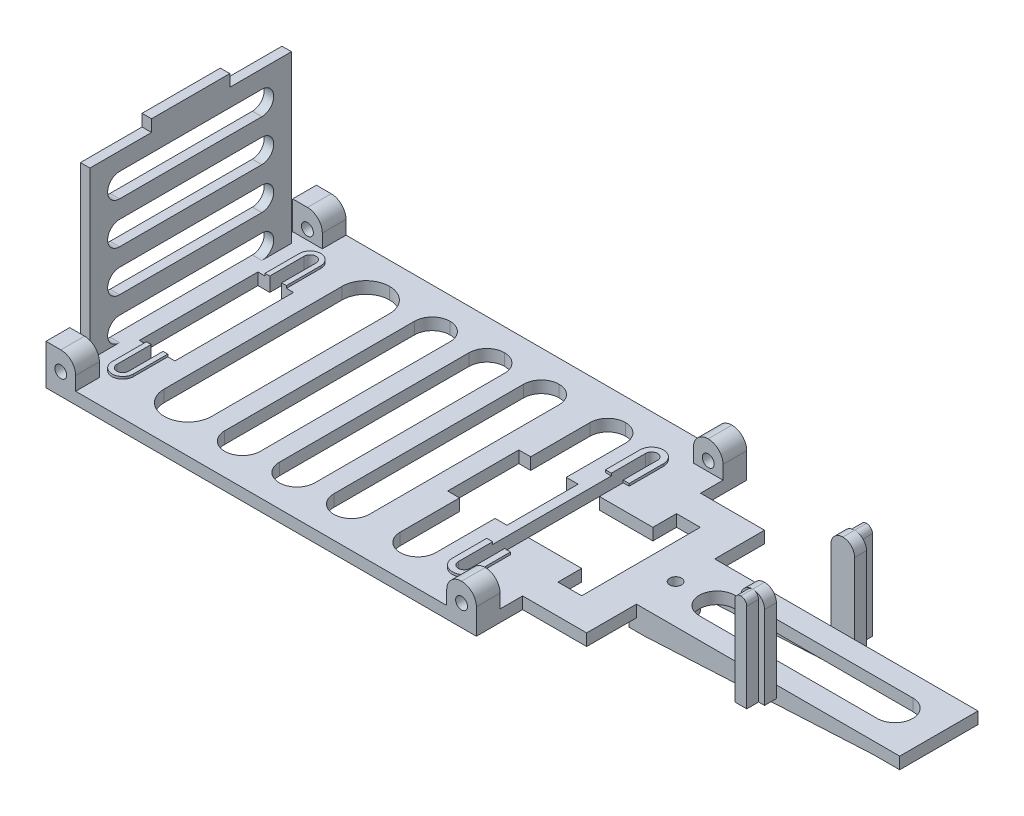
SolidWorks part; units mm, degrees
ref_plane "Face" through (0, 0, 0) normal (0, 0, 1) x (1, 0, 0)
ref_plane "Dessus" through (0, 0, 0) normal (0, 1, 0) x (1, 0, 0)
ref_plane "Droite" through (0, 0, 0) normal (1, 0, 0) x (0, 0, -1)
sketch "Esquisse1" plane through (0, 0, 0) normal (0, 1, 0) x (1, 0, 0)
  line L0 (0, 0) -> (63.89, 0)
  line L1 (0, 0) -> (0, 11.4)
  line L2 (0, 11.4) -> (36.29, 11.4)
  line L3 (36.29, 11.4) -> (36.29, 7.5)
  line L4 (36.29, 7.5) -> (41.69, 7.5)
  line L5 (41.69, 7.5) -> (41.69, 3.3)
  line L6 (41.69, 3.3) -> (63.89, 3.3)
  line L7 (63.89, 3.3) -> (63.89, 0)
  dimension "D1" = 11.4
  dimension "D2" = 36.29
  dimension "D3" = 5.4
  dimension "D4" = 22.2
  dimension "D5" = 7.5
  dimension "D6" = 3.3
extrude "Extrusion1" add sketch "Esquisse1" along normal blind 1
sketch "Esquisse2" plane through (0, 1, 0) normal (0, 1, 0) x (-1, 0, 0)
  line L0 (-1.47, 0) -> (-1.47, -5)
  line L1 (0, 0) -> (-63.89, 0) construction
  line L2 (-1.47, -5) -> (-2.47, -5)
  line L3 (-2.47, -5) -> (-2.47, -8.4)
  line L4 (-2.47, -8.4) -> (-3.47, -8.4)
  line L5 (-3.47, -8.4) -> (-3.47, -5)
  line L6 (-3.47, -5) -> (-4.47, -5)
  line L7 (-4.47, -5) -> (-4.47, 0)
  line L8 (-4.47, 0) -> (-1.47, 0)
  line L9 (-2.97, -8.4) -> (-2.97, 0) construction
  line L10 (0, -11.4) -> (0, 0) construction
  line L11 (-16.27, 0) -> (-19.27, 0)
  line L12 (-6.07, 0) -> (-10.07, 0)
  line L13 (-6.07, 0) -> (-6.07, -9.5)
  line L14 (-6.07, -9.5) -> (-10.07, -9.5)
  line L15 (-10.07, 0) -> (-10.07, -9.5)
  line L16 (-11.67, 0) -> (-14.67, 0)
  line L17 (-11.67, 0) -> (-11.67, -9.5)
  line L18 (-11.67, -9.5) -> (-14.67, -9.5)
  line L19 (-14.67, 0) -> (-14.67, -9.5)
  line L20 (-16.27, 0) -> (-16.27, -9.5)
  line L21 (-16.27, -9.5) -> (-19.27, -9.5)
  line L22 (-19.27, 0) -> (-19.27, -9.5)
  line L23 (-20.87, 0) -> (-23.87, 0)
  line L24 (-20.87, 0) -> (-20.87, -9.5)
  line L25 (-20.87, -9.5) -> (-23.87, -9.5)
  line L26 (-23.87, 0) -> (-23.87, -9.5)
  line L27 (-25.47, 0) -> (-25.47, -3)
  line L28 (-25.47, -3) -> (-26.47, -3)
  line L29 (-26.47, -3) -> (-26.47, -9.5)
  line L30 (-26.47, -9.5) -> (-29.47, -9.5)
  line L31 (-29.47, -9.5) -> (-29.47, -3)
  line L32 (-29.47, -3) -> (-30.47, -3)
  line L33 (-30.47, -3) -> (-30.47, 0)
  line L34 (-30.47, 0) -> (-25.47, 0)
  line L35 (-27.97, -9.5) -> (-27.97, 0) construction
  line L36 (-31.27, 0) -> (-31.27, -8.4)
  line L37 (-31.27, -8.4) -> (-32.27, -8.4)
  line L38 (-32.27, -8.4) -> (-32.27, -3)
  line L39 (-32.27, -3) -> (-36.77, -3)
  line L40 (-36.77, -3) -> (-36.77, -5)
  line L41 (-36.77, -5) -> (-38.77, -5)
  line L42 (-38.77, -5) -> (-38.77, 0)
  line L43 (-38.77, 0) -> (-31.27, 0)
  line L45 (-41.69, -3.3) -> (-41.69, -7.5) construction
  line L46 (-63.89, 0) -> (-63.89, -3.3) construction
  line L47 (-43.69, 0) -> (-61.69, 0)
  line L48 (-43.69, 0) -> (-43.69, -1.5)
  line L49 (-43.69, -1.5) -> (-61.69, -1.5)
  line L50 (-61.69, 0) -> (-61.69, -1.5)
  line L51 (-36.29, -11.4) -> (0, -11.4) construction
  circle A0 centre (-41.69, 0) radius 0.5
  dimension "D20" = 1
  dimension "D1" = 5
  dimension "D3" = 1
  dimension "D4" = 3
  dimension "D5" = 1.47
  dimension "D6" = 1.6
  dimension "D7" = 4
  dimension "D8" = 1.6
  dimension "D9" = 3
  dimension "D10" = 1.6
  dimension "D11" = 3
  dimension "D12" = 5
  dimension "D13" = 3
  dimension "D14" = 1.6
  dimension "D15" = 0.8
  dimension "D16" = 1
  dimension "D17" = 4.5
  dimension "D18" = 2
  dimension "D19" = 5
  dimension "D21" = 1.5
  dimension "D22" = 18
  dimension "D23" = 2.2
  dimension "D24" = 9.5
  dimension "D25" = 3
extrude "Extrusion2" cut sketch "Esquisse2" against normal through all
sketch "Esquisse4" plane through (0, 0, 0) normal (-1, 0, 0) x (0, 0, 1)
  line L0 (0, 2) -> (-6, 2) construction
  line L1 (-6, 1) -> (-8.5, 1)
  line L2 (0, 3) -> (0, 4.5)
  line L3 (0, 4.5) -> (-8.5, 4.5)
  line L4 (-8.5, 1) -> (-8.5, 4.5)
  line L5 (-6, 3) -> (0, 3)
  line L6 (0, 1) -> (0, 0) construction
  line L7 (0, 1) -> (0, 3) construction
  arc A0 (-6, 1) -> (-6, 3) centre (-6, 2) cw
  dimension "D4" = 3.5
  dimension "D1" = 8.5
  dimension "D2" = 6
  dimension "D3" = 2
extrude "Extrusion3" add sketch "Esquisse4" against normal blind 0.8
pattern_linear "Répétition linéaire1" count 4 spacing 3.5 along (0, 1, 0) of "Extrusion3"
sketch "Esquisse5" plane through (0, 0, 0) normal (-1, 0, 0) x (0, 0, 1)
  line L1 (0, 15) -> (-3.3, 15)
  line L2 (0, 15) -> (0, 16)
  line L3 (0, 16) -> (-3.3, 16)
  line L4 (-3.3, 15) -> (-3.3, 16)
  dimension "D1" = 1
  dimension "D2" = 3.3
extrude "Extrusion4" add sketch "Esquisse5" against normal up to surface (0.8 mm away)
sketch "Esquisse10" plane through (0, 0, 0) normal (0, 1, 0) x (-1, 0, 0)
  line L0 (-53.49, -3.3) -> (-51.49, -3.3)
  line L1 (-63.89, -3.3) -> (-41.69, -3.3) construction
  line L2 (-51.49, -3.3) -> (-51.49, -4.3)
  line L3 (-51.49, -4.3) -> (-51.99, -4.3)
  line L4 (-53.49, -4.3) -> (-53.49, -3.3)
  line L5 (-51.99, -4.3) -> (-51.99, -5.3)
  line L6 (-51.99, -5.3) -> (-52.99, -5.3)
  line L7 (-52.99, -5.3) -> (-52.99, -4.3)
  line L8 (-52.99, -4.3) -> (-53.49, -4.3)
  line L9 (-63.89, 0) -> (-63.89, -3.3) construction
  dimension "D1" = 1
  dimension "D2" = 2
  dimension "D3" = 12.4
  dimension "D4" = 0.5
  dimension "D5" = 1
  dimension "D6" = 1
extrude "Extrusion9" add sketch "Esquisse10" along normal blind 8
fillet "Congé2" radius 1.5 10 edges at (14.67, 0.5, -9.5) (19.27, 0.5, -9.5) (23.87, 0.5, -9.5) (11.67, 0.5, -9.5) (16.27, 0.5, -9.5) (20.87, 0.5, -9.5) (26.47, 0.5, -9.5) (29.47, 0.5, -9.5) (43.69, 0.5, -1.5) (61.69, 0.5, -1.5)
fillet "Congé3" radius 2 2 edges at (10.07, 0.5, -9.5) (6.07, 0.5, -9.5)
fillet "Congé4" radius 0.5 6 edges at (3.47, 0.5, -8.4) (2.47, 0.5, -8.4) (31.27, 0.5, -8.4) (32.27, 0.5, -8.4) (52.99, 8, -4.8) (51.99, 8, -4.8)
fillet "Congé6" radius 1 2 edges at (53.49, 8, -3.8) (51.49, 8, -3.8)
sketch "Esquisse7" plane through (0, 0, -11.4) normal (0, 0, -1) x (-1, 0, 0)
  line L0 (-36.29, 0) -> (0, 0) construction
  line L1 (-36.29, 1) -> (-33.79, 1)
  line L2 (-36.29, 1) -> (-36.29, 3.4)
  line L3 (-36.29, 3.4) -> (-33.79, 3.4)
  line L4 (-33.79, 1) -> (-33.79, 3.4)
  line L5 (0, 1) -> (0, 0) construction
  line L6 (-36.29, 1) -> (0, 1) construction
  circle A0 centre (-35.045, 1.8) radius 0.5
  point P11 (-18.145, 1)
  dimension "D3" = 1
  dimension "D1" = 3.4
  dimension "D2" = 2.5
  dimension "D4" = 1.8
  dimension "D5" = 36.29
  dimension "D6" = 1.245
  dimension "D7" = 16.9
extrude "Extrusion6" add sketch "Esquisse7" against normal blind 2
sketch "Esquisse11" plane through (0, 1, 0) normal (0, 1, 0) x (1, 0, 0)
  line L0 (2.47, 5) -> (2.47, 7.9)
  line L1 (3.47, 7.9) -> (3.47, 5)
  arc A0 (2.47, 7.9) -> (3.47, 7.9) centre (2.97, 7.9) cw
extrude "Extru.-Mince1" add sketch "Esquisse11" along normal blind 0.2 thin
sketch "Esquisse12" plane through (0, 1, 0) normal (0, 1, 0) x (1, 0, 0)
  line L0 (3.87, 5) -> (32.27, 5) construction
  line L1 (32.27, 3) -> (32.27, 7.9) construction
  line L2 (32.27, 5) -> (32.27, 7.9)
  line L3 (31.27, 7.9) -> (31.27, 5)
  line L4 (31.27, 7.9) -> (31.27, 0) construction
  arc A0 (32.27, 7.9) -> (31.27, 7.9) centre (31.77, 7.9) ccw
extrude "Extru.-Mince2" add sketch "Esquisse12" along normal up to surface (0.2 mm away) thin
ref_plane "Plan1" through (18.145, 0, 0) normal (1, 0, 0) x (0, 0, -1)
mirror "Symétrie2" about plane through (18.145, 0, 0) normal (1, 0, 0) of "Extrusion6"
fillet "Congé5" radius 1.25 3 edges at (2.5, 3.4, -10.4) (33.79, 3.4, -10.4) (36.29, 3.4, -10.4)
sketch "Esquisse8" plane through (0, 0, 0) normal (0, -1, 0) x (1, 0, 0)
  line L0 (63.89, -3.3) -> (53.49, -3.3) construction
  line L1 (41.69, 0) -> (41.69, -3.3) construction
  line L2 (41.04, -1.3519) -> (41.04, -3.3)
  line L3 (41.04, -3.3) -> (42.34, -3.3)
  line L4 (42.34, -1.3519) -> (42.34, -3.3)
  arc A0 (42.34, -1.3519) -> (41.04, -1.3519) centre (41.69, 0) ccw
  circle A1 centre (41.69, 0) radius 0.5
  dimension "D1" = 3
  dimension "D2" = 1.3
extrude "Extrusion7" add sketch "Esquisse8" along normal blind 1
sketch "Esquisse9" plane through (0, 0, -3.3) normal (0, 0, -1) x (-1, 0, 0)
  line L0 (-42.34, -1) -> (-61.69, 0)
  line L1 (-61.69, 0) -> (-42.34, 0)
  line L2 (-42.34, 0) -> (-42.34, -1)
extrude "Extrusion8" add sketch "Esquisse9" against normal blind 1.3
mirror "Symétrie1" about plane through (0, 1, 0) normal (0, 0, -1)
